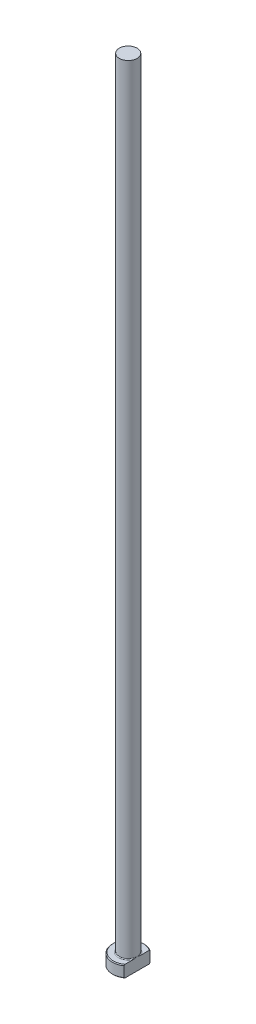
SolidWorks part; units mm, degrees
ref_plane "Front Plane" through (0, 0, 0) normal (0, 0, 1) x (1, 0, 0)
ref_plane "Top Plane" through (0, 0, 0) normal (0, 1, 0) x (1, 0, 0)
ref_plane "Right Plane" through (0, 0, 0) normal (1, 0, 0) x (0, 0, -1)
sketch "Sketch1" plane through (0, 0, 0) normal (0, 0, 1) x (1, 0, 0)
  line L0 (0, 259.9588) -> (0, -15.1925) construction
  line L1 (0, 0) -> (-4, 0)
  line L2 (-4, 0) -> (-4, 3)
  line L3 (-4, 3) -> (-2.25, 3)
  line L4 (-2.25, 3) -> (-2.25, 200)
  line L5 (-2.25, 200) -> (0, 200)
  line L6 (0, 200) -> (0, 0)
  dimension "L" = 200
  dimension "H" = 8
  dimension "T" = 3
  dimension "D" = 4.5
revolve "Revolve1" add sketch "Sketch1" angle 360 about L0
chamfer "Chamfer1" distance 0.2 angle 45 2 edges at (0, 3, 4) (0, 0, 4)
fillet "Fillet1" radius 0.2 1 edges at (0, 3, 2.25)
sketch "Sketch2" plane through (0, 0, 0) normal (0, 1, 0) x (1, 0, 0)
  line L0 (2.25, 3.3072) -> (2.25, -3.3072)
  circle A0 centre (0, 0) radius 4 construction
  arc A1 (2.25, -3.3072) -> (2.25, 3.3072) centre (0, 0) ccw
  circle A2 centre (0, 0) radius 2.25 construction
extrude "KEY" cut sketch "Sketch2" along normal through all
